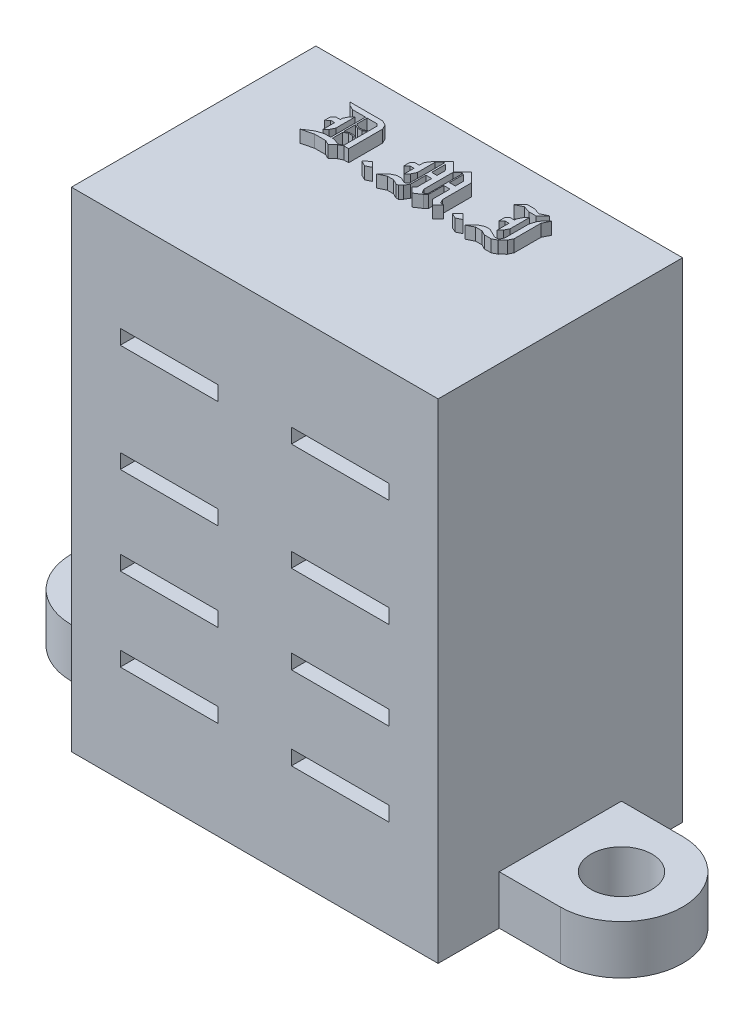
SolidWorks part; units mm, degrees
ref_plane "Front Plane" through (0, 0, 0) normal (0, 0, 1) x (1, 0, 0)
ref_plane "Top Plane" through (0, 0, 0) normal (0, 1, 0) x (1, 0, 0)
ref_plane "Right Plane" through (0, 0, 0) normal (1, 0, 0) x (0, 0, -1)
sketch "Sketch1" plane through (0, 0, 0) normal (0, 0, 1) x (1, 0, 0)
  line L0 (0, 60.2178) -> (0, -69.6479) construction
  line L1 (-85.5444, 0) -> (86.6221, 0) construction
  line L2 (-12.5, 0) -> (12.5, 0)
  line L3 (12.5, 0) -> (12.5, 2)
  line L4 (12.5, 2) -> (7.5, 2)
  line L5 (7.5, 2) -> (7.5, 20)
  line L6 (7.5, 20) -> (-7.5, 20)
  line L7 (-12.5, 0) -> (-12.5, 2)
  line L8 (-12.5, 2) -> (-7.5, 2)
  line L9 (-7.5, 2) -> (-7.5, 20)
  point P12 (0, 0)
  point P15 (0, 20)
extrude "Extrude2" add sketch "Sketch1" against normal blind 10
sketch "Sketch3" plane through (0, 0, 0) normal (0, 0, 1) x (1, 0, 0)
  line L0 (0, -0.663) -> (0, 20.6353) construction
  line L1 (-5.5, 16) -> (-1.5, 16)
  line L2 (-1.5, 16) -> (-1.5, 15.4)
  line L3 (-1.5, 15.4) -> (-5.5, 15.4)
  line L4 (-5.5, 15.4) -> (-5.5, 16)
  line L5 (1.5, 16) -> (1.5, 15.4)
  line L6 (1.5, 15.4) -> (5.5, 15.4)
  line L7 (5.5, 15.4) -> (5.5, 16)
  line L8 (5.5, 16) -> (1.5, 16)
  line L9 (-5.5, 11) -> (-1.5, 11)
  line L10 (-1.5, 11) -> (-1.5, 11.6)
  line L11 (-1.5, 11.6) -> (-5.5, 11.6)
  line L12 (-5.5, 11.6) -> (-5.5, 11)
  line L13 (-5.5, 8) -> (-1.5, 8)
  line L14 (-1.5, 8) -> (-1.5, 7.4)
  line L15 (-1.5, 7.4) -> (-5.5, 7.4)
  line L16 (-5.5, 7.4) -> (-5.5, 8)
  line L17 (-5.5, 4) -> (-1.5, 4)
  line L18 (-1.5, 4) -> (-1.5, 4.6)
  line L19 (-1.5, 4.6) -> (-5.5, 4.6)
  line L20 (-5.5, 4.6) -> (-5.5, 4)
  line L21 (5.5, 4.6) -> (5.5, 4)
  line L22 (1.5, 4.6) -> (5.5, 4.6)
  line L23 (1.5, 4) -> (1.5, 4.6)
  line L24 (5.5, 4) -> (1.5, 4)
  line L25 (5.5, 7.4) -> (5.5, 8)
  line L26 (1.5, 7.4) -> (5.5, 7.4)
  line L27 (1.5, 8) -> (1.5, 7.4)
  line L28 (5.5, 8) -> (1.5, 8)
  line L29 (5.5, 11.6) -> (5.5, 11)
  line L30 (1.5, 11.6) -> (5.5, 11.6)
  line L31 (1.5, 11) -> (1.5, 11.6)
  line L32 (5.5, 11) -> (1.5, 11)
  point P3 (-5.5, 16)
  point P12 (-5.5, 11)
  point P17 (-5.5, 8)
  point P22 (-5.5, 4)
sketch "Sketch5" plane through (0, 0, 0) normal (0, -1, 0) x (1, 0, 0)
  line L0 (-10, -2.5) -> (-7.5, -2.5)
  line L1 (7.5, 0) -> (7.5, -10)
  line L2 (-7.5, -7.5) -> (-10, -7.5)
  line L3 (0, 1.4958) -> (0, -10.5582) construction
  line L4 (-7.5, 0) -> (-7.5, -10)
  line L5 (7.5, -7.5) -> (10, -7.5)
  line L6 (10, -2.5) -> (7.5, -2.5)
  arc A0 (-10, -2.5) -> (-10, -7.5) centre (-10, -5) ccw
  arc A1 (10, -2.5) -> (10, -7.5) centre (10, -5) cw
  circle A2 centre (-10, -5) radius 1.25
  circle A3 centre (10, -5) radius 1.25
  point P0 (-10, -5)
extrude "Cut-Extrude4" cut sketch "Sketch5" against normal through all
sketch "Sketch26" plane through (0, 20, 0) normal (0, 1, 0) x (1, 0, 0)
  text T0 "D.M.I" font "GothicE" height in points 8
  point P6 (0, 1.6454)
extrude "Extrude30" add sketch "Sketch26" along normal blind 0.5
extrude "Cut-Extrude7" cut sketch "Sketch3" against normal through all
